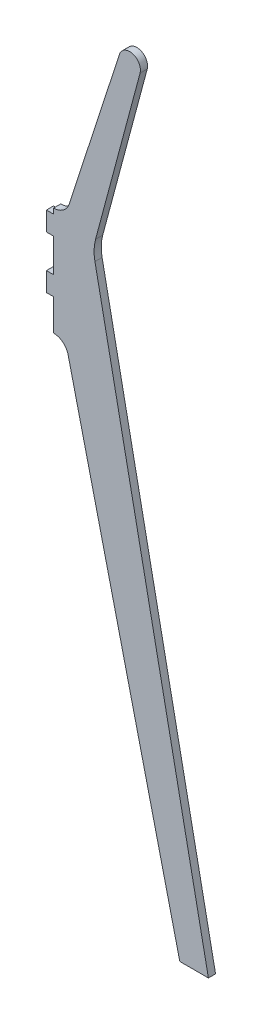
SolidWorks part; units mm, degrees
ref_plane "Alzado" through (0, 0, 0) normal (0, 0, 1) x (1, 0, 0)
ref_plane "Planta" through (0, 0, 0) normal (0, 1, 0) x (1, 0, 0)
ref_plane "Vista lateral" through (0, 0, 0) normal (1, 0, 0) x (0, 0, -1)
sketch "Croquis1" plane through (0, 0, 0) normal (0, 0, 1) x (1, 0, 0)
  line L0 (0, 0) -> (0, 50000) construction
  line L1 (-332.1792, -1195.8451) -> (-272.1792, -1195.8451) construction
  line L2 (-272.1792, -1195.8451) -> (-37.91, -210.9948) construction
  line L3 (-94.2175, -13.6041) -> (-332.1792, -1195.8451) construction
  line L4 (-188.861, 375.8218) -> (-95.5147, 27.4486) construction
  line L5 (-40.2274, 63.9478) -> (-145.7141, 388.6025) construction
  line L6 (-332.1792, -1195.8451) -> (-272.1792, -1195.8451) construction
  line L7 (-272.1792, -1195.8451) -> (-37.91, -210.9948) construction
  line L8 (-94.2175, -13.6041) -> (-332.1792, -1195.8451) construction
  line L9 (-188.861, 375.8218) -> (-95.5147, 27.4486) construction
  line L10 (-40.2274, 63.9478) -> (-145.7141, 388.6025) construction
  line L11 (40.2274, 63.9478) -> (145.7141, 388.6025)
  line L12 (188.861, 375.8218) -> (95.5147, 27.4486)
  line L13 (94.2175, -13.6041) -> (332.1792, -1195.8451)
  line L14 (272.1792, -1195.8451) -> (37.91, -210.9948)
  line L15 (332.1792, -1195.8451) -> (272.1792, -1195.8451)
  line L16 (-7.5, -80.8967) -> (7.5, -80.8967) construction
  line L17 (-7.5, -120.8967) -> (7.5, -120.8967) construction
  line L18 (-7.5, -10.8967) -> (7.5, -10.8967) construction
  line L19 (-7.5, 29.1033) -> (7.5, 29.1033) construction
  line L20 (-7.5, -80.8967) -> (7.5, -80.8967)
  line L21 (-7.5, -120.8967) -> (7.5, -120.8967)
  line L22 (-7.5, -10.8967) -> (7.5, -10.8967)
  line L23 (-7.5, 29.1033) -> (7.5, 29.1033)
  line L24 (7.5, 40.1699) -> (7.5, 29.1033)
  line L25 (-7.5, 29.1033) -> (-7.5, -10.8967)
  line L26 (7.5, -10.8967) -> (7.5, -80.8967)
  line L27 (-7.5, -80.8967) -> (-7.5, -120.8967)
  line L28 (7.5, -120.8967) -> (7.5, -186.9701)
  arc A0 (-7.5, -186.9701) -> (-37.91, -210.9948) centre (-7.5, -218.2286) ccw construction
  arc A1 (-94.2175, -13.6041) -> (-95.5147, 27.4486) centre (-182.448, 4.1549) ccw construction
  arc A2 (-145.7141, 388.6025) -> (-188.861, 375.8218) centre (-167.1202, 381.6472) ccw construction
  arc A3 (-7.5, -186.9701) -> (-37.91, -210.9948) centre (-7.5, -218.2286) ccw construction
  arc A4 (-94.2175, -13.6041) -> (-95.5147, 27.4486) centre (-182.448, 4.1549) ccw construction
  arc A5 (-145.7141, 388.6025) -> (-188.861, 375.8218) centre (-167.1202, 381.6472) ccw construction
  arc A6 (145.7141, 388.6025) -> (188.861, 375.8218) centre (167.1202, 381.6472) cw
  arc A7 (94.2175, -13.6041) -> (95.5147, 27.4486) centre (182.448, 4.1549) cw
  arc A8 (7.5, -186.9701) -> (37.91, -210.9948) centre (7.5, -218.2286) cw
  arc A9 (-40.2274, 63.9478) -> (-7.5, 40.1699) centre (-7.5, 74.5815) ccw construction
  arc A10 (-40.2274, 63.9478) -> (-7.5, 40.1699) centre (-7.5, 74.5815) ccw construction
  arc A11 (40.2274, 63.9478) -> (7.5, 40.1699) centre (7.5, 74.5815) cw
extrude "Saliente-Extruir1" add sketch "Croquis1" against normal blind 15 contours L11 A6 L12 A7 L13 L15 L14 A8 L28 L21 L27 L20 L26 L22 L25 L23 L24 A11
equation "\"Thickness\"= 15"
equation "\"D1@Saliente-Extruir1\"=\"Thickness\""
